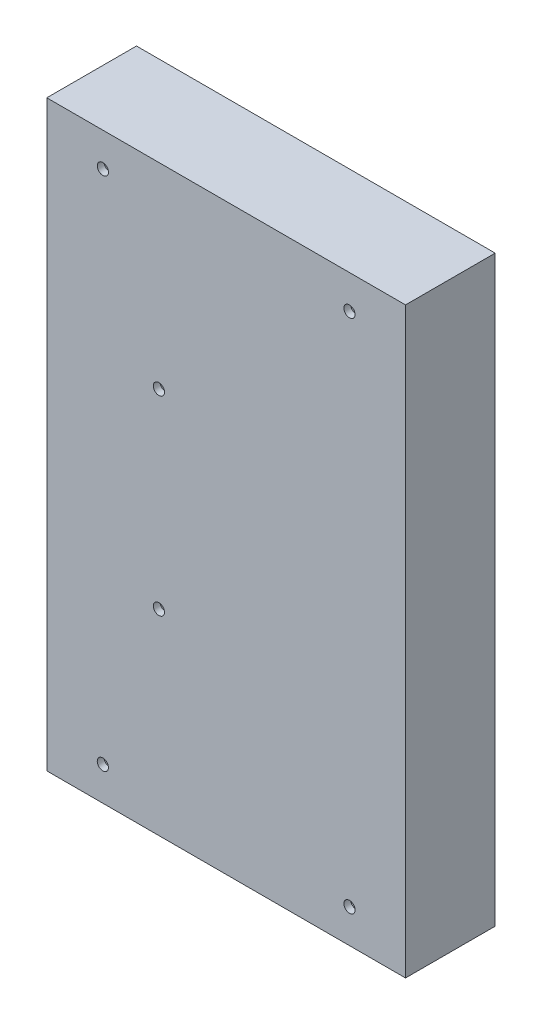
SolidWorks part; units mm, degrees
ref_plane "Alzado" through (0, 0, 0) normal (0, 0, 1) x (1, 0, 0)
ref_plane "Planta" through (0, 0, 0) normal (0, 1, 0) x (1, 0, 0)
ref_plane "Vista lateral" through (0, 0, 0) normal (1, 0, 0) x (0, 0, -1)
sketch "Croquis1" plane through (0, 0, 0) normal (0, 0, 1) x (1, 0, 0)
  line L0 (-50, 125) -> (-50, -125) construction
  line L1 (75, -125) -> (-75, -125)
  line L2 (75, -125) -> (75, 125)
  line L3 (75, 125) -> (-75, 125)
  line L4 (-75, -125) -> (-75, 125)
  line L5 (75, -125) -> (-75, 125) construction
  line L6 (75, 125) -> (-75, -125) construction
  line L7 (-75, 100) -> (-50, 100) construction
  line L8 (-50, 100) -> (-5.5811, 100) construction
  line L9 (0, 0) -> (0, 44.5924) construction
  line L10 (-30, -125) -> (-30, -100) construction
  line L11 (-30, -100) -> (-48.7392, -100) construction
  line L12 (0, 0) -> (0, -125) construction
  line L13 (0, -40) -> (14.7816, -40) construction
  circle A0 centre (-50, 100) radius 19.5
  circle A1 centre (-50, 40) radius 19.5
  circle A2 centre (-50, -20) radius 19.5
  circle A3 centre (50, -20) radius 19.5
  circle A4 centre (50, 40) radius 19.5
  circle A5 centre (50, 100) radius 19.5
  circle A6 centre (-30, -100) radius 19.5
  circle A7 centre (30, -100) radius 19.5
  circle A8 centre (0, -40) radius 19.5
  point P0 (0, 0)
  dimension "D3" = 39
  dimension "D7" = 39
  dimension "D9" = 39
  dimension "D1" = 250
  dimension "D2" = 150
  dimension "D4" = 25
  dimension "D6" = 25
  dimension "D8" = 45
  dimension "D10" = 60
  dimension "D11" = 25
  dimension "D5" = 3
extrude "Saliente-Extruir1" add sketch "Croquis1" along normal blind 10
sketch "Croquis3" plane through (0, 0, 10) normal (0, 0, 1) x (1, 0, 0)
  line L0 (-75, 125) -> (-75, -125) construction
  line L1 (80, -130) -> (-80, -130)
  line L2 (80, -130) -> (80, 130)
  line L3 (80, 130) -> (-80, 130)
  line L4 (-80, -130) -> (-80, 130)
  line L5 (80, -130) -> (-80, 130) construction
  line L6 (80, 130) -> (-80, -130) construction
  line L7 (-75, -125) -> (75, -125) construction
  line L9 (75, -125) -> (-75, -125)
  line L10 (75, -125) -> (75, 125)
  line L11 (75, 125) -> (-75, 125)
  line L12 (-75, -125) -> (-75, 125)
  line L13 (75, -125) -> (-75, 125) construction
  line L14 (75, 125) -> (-75, -125) construction
  point P0 (0, 0)
  point P10 (0, 0)
  dimension "D1" = 5
  dimension "D2" = 5
extrude "Saliente-Extruir2" add sketch "Croquis3" against normal blind 25
sketch "Croquis4" plane through (0, 0, 0) normal (0, 0, -1) x (-1, 0, 0)
  line L0 (-5, 125) -> (-5, 5)
  line L1 (-75, 125) -> (75, 125) construction
  line L2 (0, 0) -> (0, 33.3835) construction
  line L3 (5, 125) -> (4.1277, 6.4953)
  line L4 (-3.8302, -2.9947) -> (-75, -125)
  line L5 (3.8302, -2.9947) -> (75, -125)
  line L6 (-3.8302, -2.9947) -> (3.8302, -2.9947)
  line L7 (-75, -125) -> (-75, -115)
  line L8 (-75, -125) -> (-75, 125) construction
  line L9 (75, -125) -> (75, -115)
  line L10 (75, 125) -> (75, -125) construction
  line L11 (-75, -115) -> (-5, 5)
  line L12 (75, -115) -> (4.1277, 6.4953)
  line L13 (-5, 125) -> (5, 125)
  dimension "D1" = 5
  dimension "D2" = 128
  dimension "D3" = 10
  dimension "D4" = 10
extrude "Saliente-Extruir3" add sketch "Croquis4" along normal blind 15
sketch "Croquis6" plane through (0, 0, 10) normal (0, 0, 1) x (1, 0, 0)
  line L1 (80, -130) -> (-80, -130)
  line L2 (80, -130) -> (80, 130)
  line L3 (80, 130) -> (-80, 130)
  line L4 (-80, -130) -> (-80, 130)
  line L5 (75, -125) -> (-75, -125)
  line L6 (75, -125) -> (75, 125)
  line L7 (75, 125) -> (-75, 125)
  line L8 (-75, -125) -> (-75, 125)
  line L9 (75, -125) -> (-75, 125) construction
  line L10 (75, 125) -> (-75, -125) construction
  point P0 (0, 0)
  point P7 (0, 0)
  dimension "D1" = 5
  dimension "D2" = 5
  dimension "D3" = 130
extrude "Saliente-Extruir4" add sketch "Croquis6" along normal blind 15
sketch "Croquis7" plane through (0, 0, 25) normal (0, 0, 1) x (1, 0, 0)
  line L1 (80, -130) -> (-80, -130)
  line L2 (80, -130) -> (80, 130)
  line L3 (80, 130) -> (-80, 130)
  line L4 (-80, -130) -> (-80, 130)
  line L5 (80, -130) -> (-80, 130) construction
  line L6 (80, 130) -> (-80, -130) construction
  point P0 (0, 0)
extrude "Saliente-Extruir5" add sketch "Croquis7" against normal blind 5
sketch "Croquis8" plane through (0, 0, 25) normal (0, 0, 1) x (1, 0, 0)
  line L0 (-80, 0) -> (0, 0) construction
  line L1 (-80, 130) -> (-80, -130) construction
  line L2 (-80, 42.5) -> (-30, 42.5) construction
  circle A0 centre (-30, 42.5) radius 2.5
  circle A1 centre (-30, -42.5) radius 2.5
  dimension "D3" = 5
  dimension "D1" = 42.5
  dimension "D2" = 50
extrude "Cortar-Extruir1" cut sketch "Croquis8" against normal blind 3
sketch "Croquis9" plane through (0, 0, 25) normal (0, 0, 1) x (1, 0, 0)
  line L0 (-80, 115) -> (80, 115) construction
  line L1 (-80, 130) -> (-80, -130) construction
  line L2 (80, -130) -> (80, 130) construction
  line L3 (-55, 130) -> (-55, 115) construction
  line L4 (80, 130) -> (-80, 130) construction
  line L5 (0, 0) -> (0, 42.0452) construction
  line L6 (0, 0) -> (49.4437, 0) construction
  circle A0 centre (-55, 115) radius 2.5
  circle A1 centre (55, 115) radius 2.5
  circle A2 centre (55, -115) radius 2.5
  circle A3 centre (-55, -115) radius 2.5
  dimension "D1" = 5
  dimension "D2" = 25
  dimension "D3" = 15
extrude "Cortar-Extruir2" cut sketch "Croquis9" against normal blind 3
